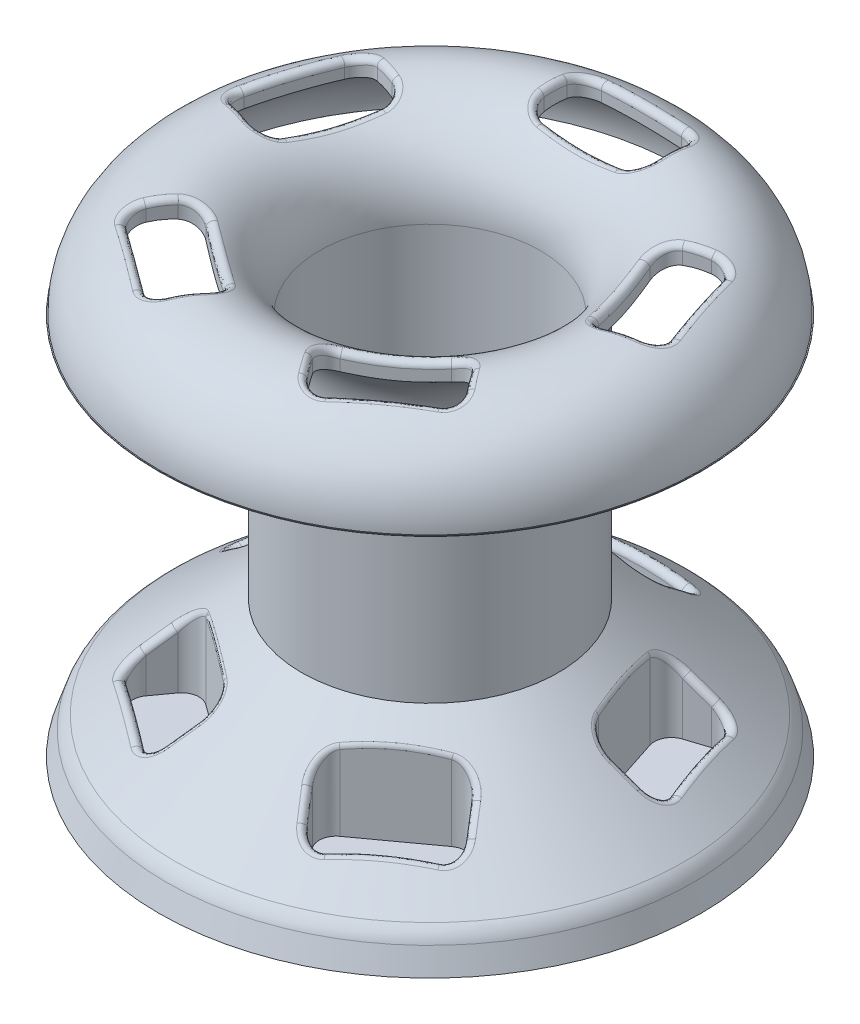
SolidWorks part; units mm, degrees
ref_plane "Front" through (0, 0, 0) normal (0, 0, 1) x (1, 0, 0)
ref_plane "Top" through (0, 0, 0) normal (0, 1, 0) x (1, 0, 0)
ref_plane "Right" through (0, 0, 0) normal (1, 0, 0) x (0, 0, -1)
sketch "Sketch1" plane through (0, 0, 0) normal (0, 1, 0) x (1, 0, 0)
  circle A0 centre (0, 0) radius 47.5
  dimension "D1" = 95
extrude "Extrude1" add sketch "Sketch1" along normal blind 100
sketch "Sketch2" plane through (0, 0, 0) normal (0, 0, 1) x (1, 0, 0)
  line L3 (0, 46.25) -> (0, 33.4722) construction
  line L4 (22.5, 67) -> (22.5, 24)
  line L7 (0, 100) -> (0, 0) construction
  line L9 (47.5, 67) -> (51.25, 67)
  line L11 (22.5, 24) -> (44.5437, 6.3387)
  line L12 (46.1608, 4.0177) -> (47.5, 0)
  line L13 (51.25, 67) -> (51.25, 0)
  line L14 (47.5, 0) -> (51.25, 0)
  arc A0 (22.5, 67) -> (44.5, 67) centre (33.5, 67) cw
  arc A1 (44.5437, 6.3387) -> (46.1608, 4.0177) centre (41.4173, 2.4366) cw
  arc A3 (44.5, 67) -> (47.5, 67) centre (46, 68.6563) ccw
  dimension "D2" = 5
  dimension "D1" = 22.5
revolve "Cut-Revolve1" cut sketch "Sketch2" angle 360 about L3
sketch "Sketch3" plane through (0, 0, 0) normal (0, 0, 1) x (1, 0, 0)
  line L0 (0, 100) -> (0, 67) construction
  line L1 (52.5, 67.0833) -> (47.3333, 67.0833)
  line L2 (52.5, 67.0833) -> (52.5, 83.3333)
  line L3 (52.5, 83.3333) -> (0, 83.3333)
  line L4 (0, 67.0833) -> (0, 83.3333)
  line L5 (0, 62.5) -> (0, 52.9167) construction
  line L6 (19.3333, 67.0833) -> (0, 67.0833)
  arc A0 (47.3333, 67.0833) -> (19.3333, 67.0833) centre (33.3333, 67.0833) ccw
revolve "Cut-Revolve2" cut sketch "Sketch3" angle 360 about L5
delete or keep bodies "Body-Delete1" type delete bodies bodies 104
sketch "Sketch4" plane through (0, 67.0833, 0) normal (0, 1, 0) x (-1, 0, 0)
  circle A1 centre (0, 0) radius 19.3333
  circle A2 centre (0, 0) radius 19.3333
  dimension "D1" = 0
extrude "Cut-Extrude1" cut sketch "Sketch4" against normal offset from surface (61.0833 mm away) 6
ref_plane "Plane1" through (0, 90, 0) normal (0, 1, 0) x (-1, 0, 0)
sketch "Sketch5" plane through (0, 90, 0) normal (0, 1, 0) x (-1, 0, 0)
  line L1 (-7, -27) -> (7, -27)
  line L2 (-10, -30) -> (-10, -34)
  line L3 (-7, -37) -> (7, -37)
  line L4 (10, -30) -> (10, -34)
  line L6 (-27.8416, -1.6861) -> (-23.5154, -15.0009)
  line L7 (-31.6219, 0.2401) -> (-35.4261, -0.996)
  line L8 (-37.3522, -4.7762) -> (-33.026, -18.091)
  line L9 (-25.4415, -18.7811) -> (-29.2458, -20.0171)
  line L10 (-10.2071, 25.958) -> (-21.5333, 17.729)
  line L11 (-9.5434, 30.1484) -> (-11.8945, 33.3844)
  line L12 (-16.0849, 34.0481) -> (-27.4112, 25.8191)
  line L13 (-25.7237, 18.3927) -> (-28.0749, 21.6287)
  line L14 (21.5333, 17.729) -> (10.2071, 25.958)
  line L15 (25.7237, 18.3927) -> (28.0749, 21.6287)
  line L16 (27.4112, 25.8191) -> (16.0849, 34.0481)
  line L17 (9.5434, 30.1484) -> (11.8945, 33.3844)
  line L18 (23.5154, -15.0009) -> (27.8416, -1.6861)
  line L19 (25.4415, -18.7811) -> (29.2458, -20.0171)
  line L20 (33.026, -18.091) -> (37.3522, -4.7762)
  line L21 (31.6219, 0.2401) -> (35.4261, -0.996)
  arc A0 (-7, -27) -> (-10, -30) centre (-7, -30) ccw
  arc A1 (-10, -34) -> (-7, -37) centre (-7, -34) ccw
  circle A2 centre (0, 0) radius 19.3333 construction
  circle A3 centre (0, 0) radius 19.3333
  arc A4 (7, -37) -> (10, -34) centre (7, -34) ccw
  arc A5 (7, -27) -> (10, -30) centre (7, -30) cw
  arc A6 (23.5154, -15.0009) -> (25.4415, -18.7811) centre (26.3686, -15.9279) ccw
  arc A7 (29.2458, -20.0171) -> (33.026, -18.091) centre (30.1728, -17.164) ccw
  arc A8 (37.3522, -4.7762) -> (35.4261, -0.996) centre (34.499, -3.8492) ccw
  arc A9 (27.8416, -1.6861) -> (31.6219, 0.2401) centre (30.6948, -2.6131) cw
  arc A10 (21.5333, 17.729) -> (25.7237, 18.3927) centre (23.2967, 20.156) ccw
  arc A11 (28.0749, 21.6287) -> (27.4112, 25.8191) centre (25.6478, 23.3921) ccw
  arc A12 (16.0849, 34.0481) -> (11.8945, 33.3844) centre (14.3216, 31.6211) ccw
  arc A13 (10.2071, 25.958) -> (9.5434, 30.1484) centre (11.9704, 28.385) cw
  arc A14 (-11.8945, 33.3844) -> (-16.0849, 34.0481) centre (-14.3216, 31.6211) ccw
  arc A15 (-10.2071, 25.958) -> (-9.5434, 30.1484) centre (-11.9704, 28.385) ccw
  arc A16 (-27.4112, 25.8191) -> (-28.0749, 21.6287) centre (-25.6478, 23.3921) ccw
  arc A17 (-21.5333, 17.729) -> (-25.7237, 18.3927) centre (-23.2967, 20.156) cw
  arc A18 (-27.8416, -1.6861) -> (-31.6219, 0.2401) centre (-30.6948, -2.6131) ccw
  arc A19 (-23.5154, -15.0009) -> (-25.4415, -18.7811) centre (-26.3686, -15.9279) cw
  arc A20 (-33.026, -18.091) -> (-29.2458, -20.0171) centre (-30.1728, -17.164) ccw
  arc A21 (-35.4261, -0.996) -> (-37.3522, -4.7762) centre (-34.499, -3.8492) ccw
  point P28 (-10, -37)
  point P31 (10, -37)
  point P34 (10, -27)
  dimension "D4" = 3
  dimension "D1" = 10
  dimension "D2" = 10
  dimension "D3" = 20
extrude "Cut-Extrude2" cut sketch "Sketch5" against normal offset from surface (84 mm away) 6
shell "Shell2" thickness 1
fillet "Fillet1" radius 1 88 edges at (-28.6435, 80.5717, 23.5531) (-23.3794, 80.3956, 17.1572) (-8.9726, 80.5929, 28.2705) (-14.2636, 80.4663, 34.6205) (-29.2075, 18.626, -0.0078) (-37.1309, 12.2152, -2.4093) (-31.4321, 12.2265, -19.8869) (-23.4772, 18.9307, -16.728) (-9.6999, 17.723, -27.0486) (-9.9292, 10.266, -36.7239) (9.9304, 10.2667, -36.7226) (9.201, 18.1493, -26.66) (23.6339, 18.626, -17.1614) (31.4557, 12.2152, -19.8758) (37.1183, 12.2265, -2.3865) (28.826, 18.9307, -0.2663) (11.9433, 20.0478, 24.6965) (23.6248, 18.626, 17.174) (28.6234, 12.2152, 23.7742) (13.7398, 12.2265, 34.5641) (-13.7655, 12.2152, 34.5691) (-28.6266, 12.2265, 23.7483) (-23.1641, 18.9307, 17.1589) (-19.7971, 20.0478, 18.9904) (-9.033, 18.626, 27.7756) (24.1141, 80.5929, 17.2695) (28.5184, 80.4663, 24.2638) (13.549, 80.5717, 34.5199) (9.0928, 80.3956, 27.537) (23.876, 80.5929, -17.5973) (31.8889, 80.4663, -19.6247) (37.0173, 80.5716, -2.2187) (28.9991, 80.3956, -0.1383) (-9.3579, 80.5929, -28.1452) (-8.81, 80.4663, -36.3925) (9.3289, 80.5716, -35.8911) (10, 53.1485, -33.2095) (8.8297, 80.3956, -27.6225) (-29.6595, 80.5929, 0.2026) (-37.3337, 80.4663, -2.8671) (-31.2517, 80.5716, -19.9632) (-23.5421, 80.3956, -16.9333) (-24.1786, 20.0478, -12.9598) (4.4734, 19.6084, -26) (27.1785, 20.0478, -3.7271) (9.161, 18.9307, 27.3328) (-1.7454, 54.5694, -27) (8.6544, 18.9306, -27.4974) (-9.0182, 18.626, -27.7804) (-9.1827, 12.2152, -36.0581) (9.2005, 12.2264, -36.0391)
